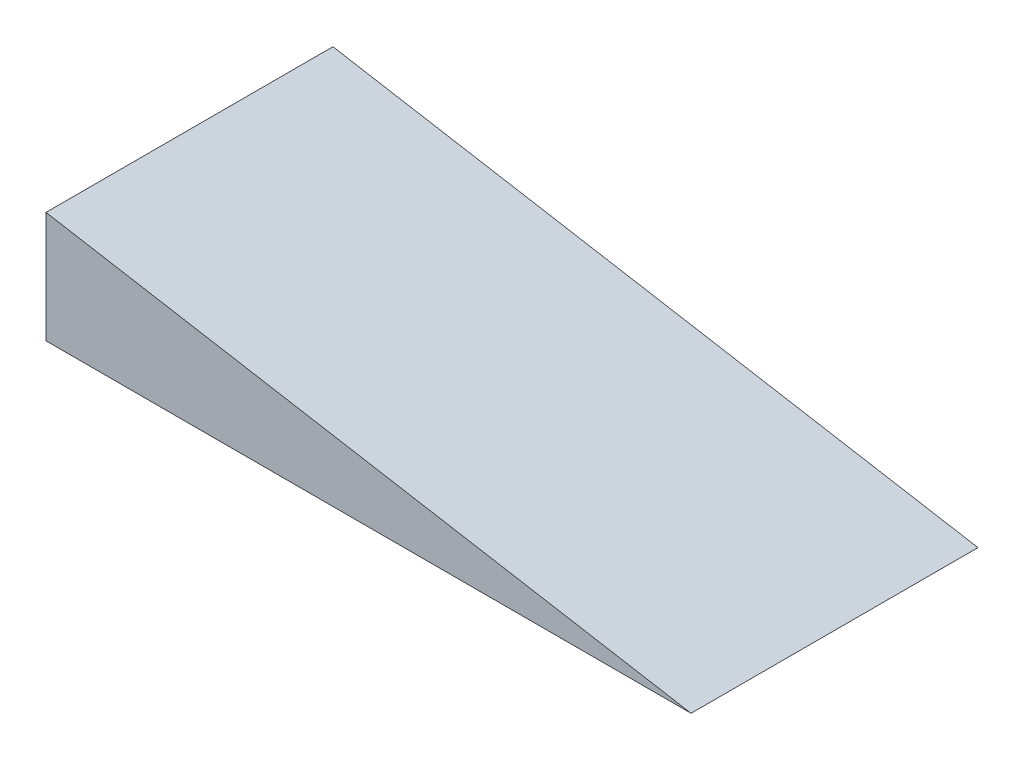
SolidWorks part; units mm, degrees
ref_plane "Plan de face" through (0, 0, 0) normal (0, 0, 1) x (1, 0, 0)
ref_plane "Plan de dessus" through (0, 0, 0) normal (0, 1, 0) x (1, 0, 0)
ref_plane "Plan de droite" through (0, 0, 0) normal (1, 0, 0) x (0, 0, -1)
sketch "Esquisse3" plane through (0, 0, 0) normal (0, 0, 1) x (1, 0, 0)
  line L0 (-141.9543, -27.1942) -> (-141.9543, 73.2454)
  line L1 (-141.9543, 73.2454) -> (440.3406, -27.1942)
  line L2 (440.3406, -27.1942) -> (-141.9543, -27.1942)
extrude "Boss.-Extru.3" add sketch "Esquisse3" along normal blind 100 and the other way blind 159
